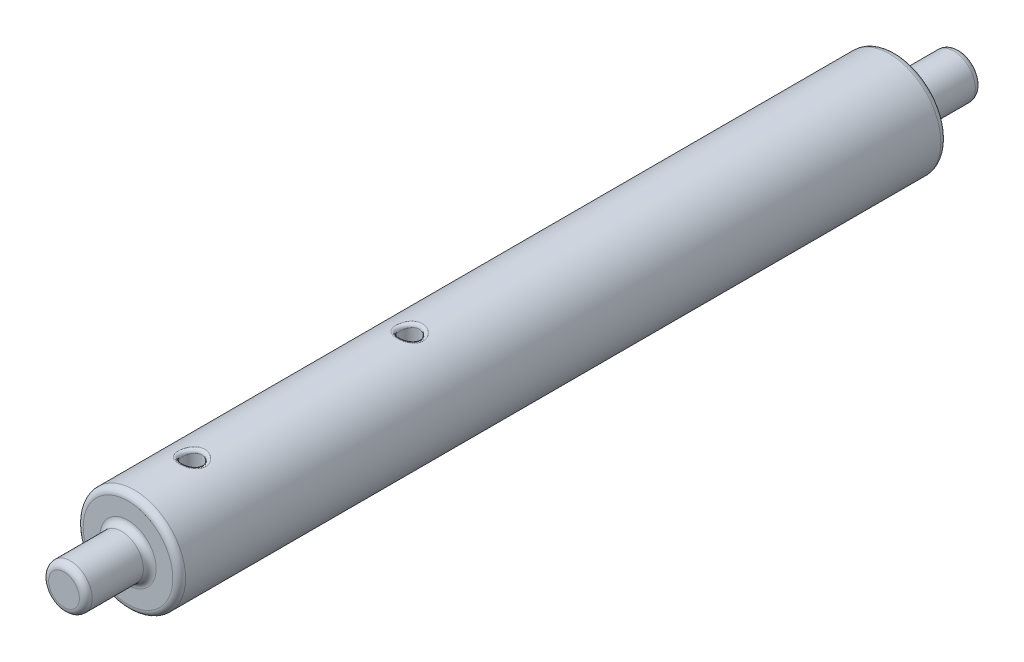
SolidWorks part; units mm, degrees
ref_plane "Спереди" through (0, 0, 0) normal (0, 0, 1) x (1, 0, 0)
ref_plane "Сверху" through (0, 0, 0) normal (0, 1, 0) x (1, 0, 0)
ref_plane "Справа" through (0, 0, 0) normal (1, 0, 0) x (0, 0, -1)
sketch "Эскиз1" plane through (0, 0, 0) normal (1, 0, 0) x (0, 0, -1)
  line L0 (-35, 0) -> (35, 0)
  line L1 (35, 0) -> (35, 1.7)
  line L2 (35, 1.7) -> (30, 1.7)
  line L3 (30, 1.7) -> (30, 4)
  line L4 (30, 4) -> (-30, 4)
  line L5 (-30, 4) -> (-30, 1.7)
  line L6 (-30, 1.7) -> (-35, 1.7)
  line L7 (-35, 1.7) -> (-35, 0)
  dimension "D1" = 1.7
  dimension "D2" = 5
  dimension "D3" = 60
  dimension "D4" = 4
revolve "Повернуть1" add sketch "Эскиз1" angle 360 about L0
fillet "Скругление1" radius 0.5 6 edges at (4, 0, -30) (4, 0, 30) (1.7, 0, -35) (1.7, 0, -30) (1.7, 0, 30) (1.7, 0, 35)
sketch "Эскиз2" plane through (0, 0, 0) normal (0, 1, 0) x (1, 0, 0)
  line L0 (-2.2, -30) -> (2.2, -30) construction
  circle A0 centre (0, -25) radius 0.75
  circle A1 centre (0, -8) radius 0.75
  dimension "D1" = 1.5
  dimension "D2" = 5
  dimension "D3" = 22
extrude "Вырез-Вытянуть1" cut sketch "Эскиз2" against normal mid plane 10
fillet "Скругление2" radius 0.25 4 edges at (-0.1578, -3.9969, 24.2668) (0.1578, 3.9969, 24.2668) (-0.1578, -3.9969, 7.2668) (0.1578, 3.9969, 7.2668)
